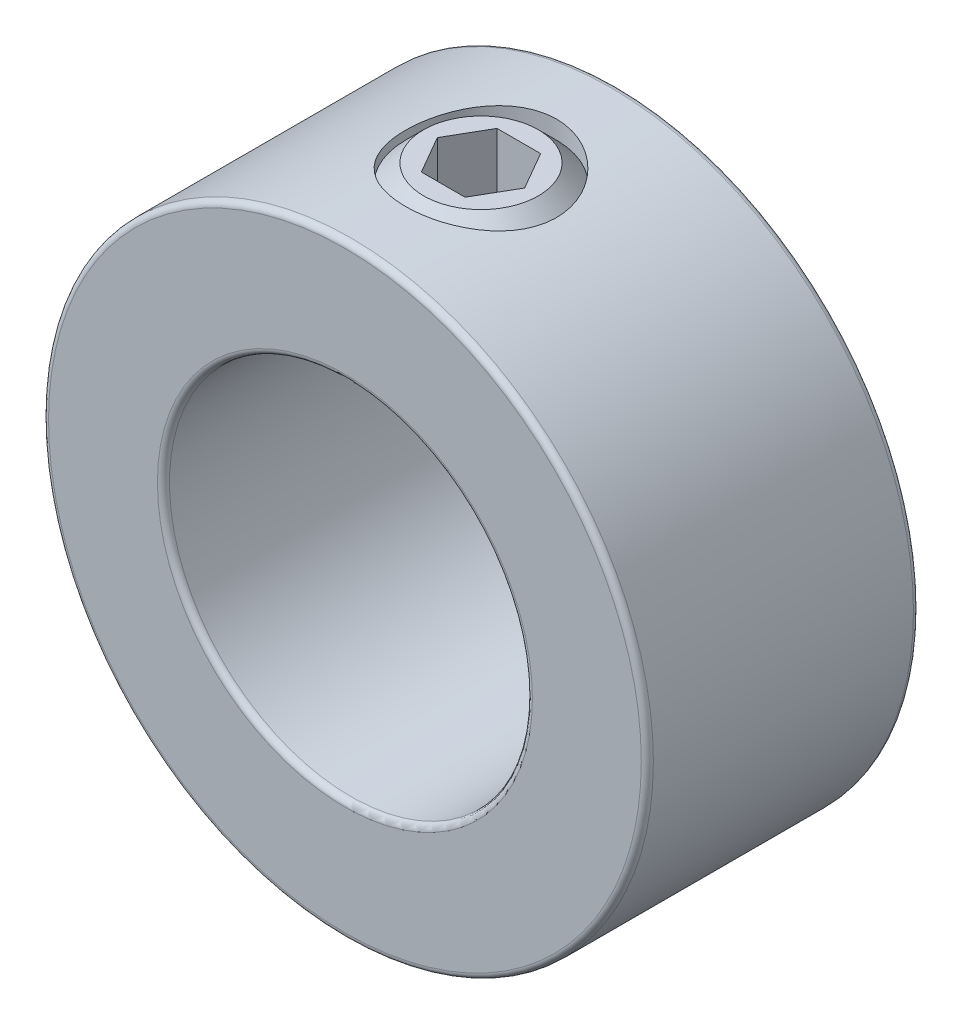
SolidWorks part; units mm, degrees
ref_plane "Front Plane" through (0, 0, 0) normal (0, 0, 1) x (1, 0, 0)
ref_plane "Top Plane" through (0, 0, 0) normal (0, 1, 0) x (1, 0, 0)
ref_plane "Right Plane" through (0, 0, 0) normal (1, 0, 0) x (0, 0, -1)
sketch "Sketch1" plane through (0, 0, 0) normal (0, 0, 1) x (1, 0, 0)
  circle A0 centre (0, 0) radius 15.875
  circle A1 centre (0, 0) radius 9.525
  point P4 (15.875, 0)
extrude "Extrude1" add sketch "Sketch1" along normal mid plane 14.2875
sketch "Sketch2" plane through (41.275, 0, 0) normal (0, -1, 0) x (0, 0, -1)
  line L0 (7.1437, -41.275) -> (-7.1438, -41.275) construction
  line L1 (-7.1437, -25.4) -> (-7.1437, -57.15) construction
  line L2 (7.1437, -57.15) -> (7.1437, -25.4) construction
  circle A0 centre (0, -41.275) radius 3.9688
  point P7 (0, -45.2437)
extrude "Cut-Extrude1" cut sketch "Sketch2" against normal through all
fillet "Fillet1" radius 0.3175 4 edges at (9.525, 0, -7.1437) (9.525, 0, 7.1437) (15.875, 0, -7.1437) (15.875, 0, 7.1437)
sketch "Sketch3" plane through (0, 0, 0) normal (0, 0, 1) x (1, 0, 0)
  line L0 (-3.0102, 9.525) -> (-1.1502, 9.525)
  line L1 (0, 10.6752) -> (-1.1502, 9.525)
  line L2 (0, 10.6752) -> (0, 15.875)
  line L3 (0, 15.875) -> (-3.0102, 15.875)
  line L4 (-3.9688, 10.4835) -> (-3.9688, 14.9165)
  line L5 (0, 9.525) -> (0, 0) construction
  line L6 (-3.9688, 10.4835) -> (-3.9688, 9.525) construction
  line L7 (-3.9688, 9.525) -> (-3.0102, 9.525) construction
  line L8 (-3.9688, 14.9165) -> (-3.9688, 15.875) construction
  line L9 (-3.0102, 9.525) -> (-3.9688, 10.4835)
  line L10 (-3.9688, 14.9165) -> (-3.0102, 15.875)
  line L11 (-3.9688, 15.875) -> (-3.0102, 15.875) construction
  line L12 (-1.1502, 9.525) -> (0, 9.525) construction
  line L13 (0, 9.525) -> (0, 10.6752) construction
  circle A1 centre (0, 0) radius 9.525 construction
revolve "Revolve1" add sketch "Sketch3" angle 360 about L5
sketch "Sketch4" plane through (3.3734, 15.875, 0) normal (0, -1, 0) x (0, 0, -1)
  line L1 (0, -1.0821) -> (-1.9844, -2.2278)
  line L2 (-1.9844, -2.2278) -> (-1.9844, -4.5191)
  line L3 (-1.9844, -4.5191) -> (0, -5.6648)
  line L4 (0, -5.6648) -> (1.9844, -4.5191)
  line L5 (1.9844, -4.5191) -> (1.9844, -2.2278)
  line L6 (1.9844, -2.2278) -> (0, -1.0821)
  circle A0 centre (0, -3.3734) radius 1.9844 construction
  circle A1 centre (0, -3.3734) radius 2.2914 construction
extrude "Cut-Extrude2" cut sketch "Sketch4" along normal blind 3.9688
equation "\"D1@Fillet1\" = \"OD@Sketch1\"*.01"
equation "\"D1@Cut-Extrude2\" = \"Hex Size@Sketch4\""
equation "\"D2@Sketch3\" =(\"Set Screw Dia@Sketch2\"-\"D1@Sketch4\")/3.5"
equation "\"D1@Sketch3\" = \"D2@Sketch3\"*1.2"
